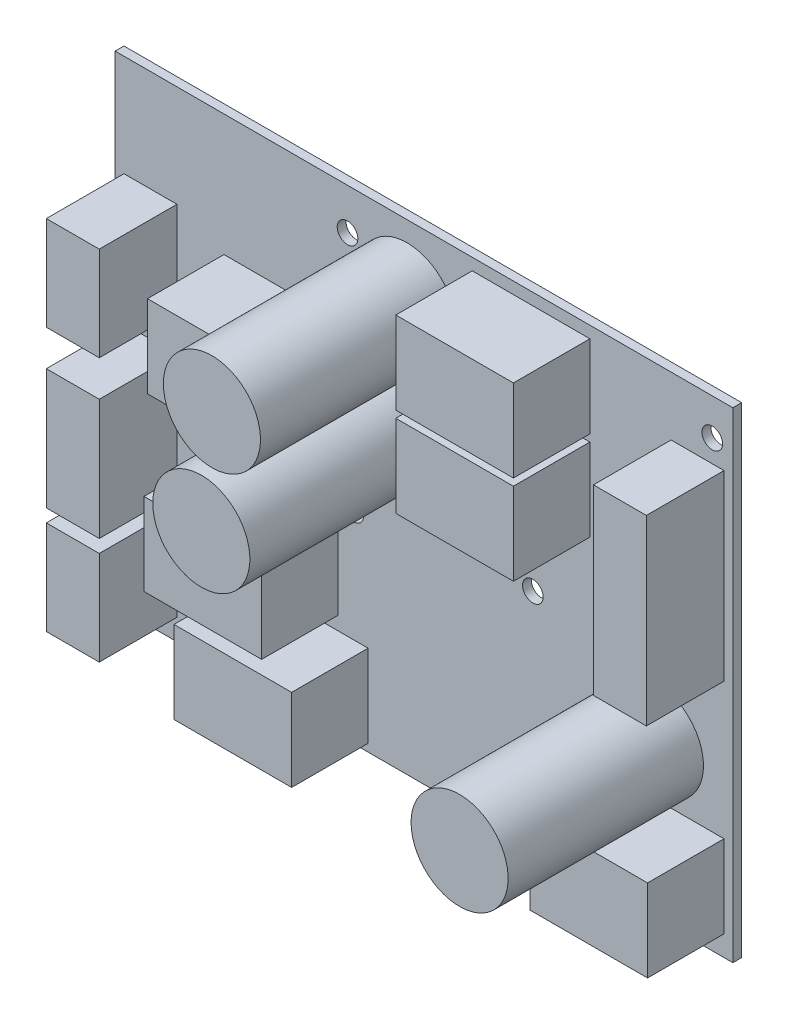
SolidWorks part; units mm, degrees
ref_plane "Přední rovina" through (0, 0, 0) normal (0, 0, 1) x (1, 0, 0)
ref_plane "Horní rovina" through (0, 0, 0) normal (0, 1, 0) x (1, 0, 0)
ref_plane "Pravá rovina" through (0, 0, 0) normal (1, 0, 0) x (0, 0, -1)
sketch "Skica1" plane through (0, 0, 0) normal (0, 0, 1) x (1, 0, 0)
  line L1 (-92.1941, -230.2817) -> (12.8059, -230.2817)
  line L2 (-92.1941, -230.2817) -> (-92.1941, -311.9817)
  line L3 (-92.1941, -311.9817) -> (12.8059, -311.9817)
  line L4 (12.8059, -230.2817) -> (12.8059, -311.9817)
  line L5 (-92.1941, -230.2817) -> (12.8059, -311.9817) construction
  line L6 (-92.1941, -311.9817) -> (12.8059, -230.2817) construction
  circle A0 centre (-21.1941, -274.2817) radius 1.75
  circle A1 centre (9.3059, -236.4817) radius 1.75
  circle A2 centre (-52.6941, -237.2817) radius 1.75
  circle A3 centre (-51.6941, -277.5817) radius 1.75
  point P0 (-39.6941, -271.1317)
  dimension "D3" = 3.5
  dimension "D1" = 6.2
  dimension "D2" = 105
  dimension "D4" = 37.7
  dimension "D5" = 34
  dimension "D6" = 3.5
  dimension "D7" = 81.7
  dimension "D8" = 34.4
  dimension "D9" = 7
  dimension "D10" = 39.5
  dimension "D11" = 40.5
extrude "Přidat vysunutím1" add sketch "Skica1" along normal blind 1.5
sketch "Skica3" plane through (0, 0, 1.5) normal (0, 0, 1) x (1, 0, 0)
  line L0 (12.8059, -230.2817) -> (-92.1941, -230.2817) construction
  line L1 (-90.6941, -247.5817) -> (-81.6941, -247.5817)
  line L2 (-90.6941, -247.5817) -> (-90.6941, -263.5817)
  line L3 (-90.6941, -263.5817) -> (-81.6941, -263.5817)
  line L4 (-81.6941, -247.5817) -> (-81.6941, -263.5817)
  line L5 (-90.6941, -247.5817) -> (-81.6941, -263.5817) construction
  line L6 (-90.6941, -263.5817) -> (-81.6941, -247.5817) construction
  line L7 (-90.6941, -269.6817) -> (-81.6941, -269.6817)
  line L8 (-90.6941, -269.6817) -> (-90.6941, -290.1817)
  line L9 (-90.6941, -290.1817) -> (-81.6941, -290.1817)
  line L10 (-81.6941, -269.6817) -> (-81.6941, -290.1817)
  line L11 (-90.6941, -269.6817) -> (-81.6941, -290.1817) construction
  line L12 (-90.6941, -290.1817) -> (-81.6941, -269.6817) construction
  line L13 (-90.6941, -292.3817) -> (-81.6941, -292.3817)
  line L14 (-90.6941, -292.3817) -> (-90.6941, -308.3817)
  line L15 (-90.6941, -308.3817) -> (-81.6941, -308.3817)
  line L16 (-81.6941, -292.3817) -> (-81.6941, -308.3817)
  line L17 (-90.6941, -292.3817) -> (-81.6941, -308.3817) construction
  line L18 (-90.6941, -308.3817) -> (-81.6941, -292.3817) construction
  line L19 (2.3059, -240.2817) -> (11.3059, -240.2817)
  line L20 (2.3059, -240.2817) -> (2.3059, -271.2817)
  line L21 (2.3059, -271.2817) -> (11.3059, -271.2817)
  line L22 (11.3059, -240.2817) -> (11.3059, -271.2817)
  line L23 (2.3059, -240.2817) -> (11.3059, -271.2817) construction
  line L24 (2.3059, -271.2817) -> (11.3059, -240.2817) construction
  line L25 (12.8059, -311.9817) -> (12.8059, -230.2817) construction
  line L26 (-92.1941, -230.2817) -> (-92.1941, -311.9817) construction
  line L27 (-92.1941, -311.9817) -> (12.8059, -311.9817) construction
  point P0 (-86.1941, -255.5817)
  point P5 (-86.1941, -279.9317)
  point P10 (-86.1941, -300.3817)
  point P15 (6.8059, -255.7817)
  dimension "D1" = 9
  dimension "D2" = 16
  dimension "D3" = 20.5
  dimension "D4" = 31
  dimension "D5" = 10
  dimension "D6" = 1.5
  dimension "D7" = 1.5
  dimension "D8" = 1.5
  dimension "D9" = 1.5
  dimension "D10" = 3.6
  dimension "D11" = 2.2
  dimension "D12" = 6.1
extrude "Přidat vysunutím2" add sketch "Skica3" along normal blind 13.2
sketch "Skica4" plane through (0, 0, 1.5) normal (0, 0, 1) x (1, 0, 0)
  line L0 (-92.1941, -311.9817) -> (12.8059, -311.9817) construction
  line L1 (-73.6941, -250.9817) -> (-53.6941, -250.9817)
  line L2 (-73.6941, -250.9817) -> (-73.6941, -264.9817)
  line L3 (-73.6941, -264.9817) -> (-53.6941, -264.9817)
  line L4 (-53.6941, -250.9817) -> (-53.6941, -264.9817)
  line L5 (-73.6941, -250.9817) -> (-53.6941, -264.9817) construction
  line L6 (-73.6941, -264.9817) -> (-53.6941, -250.9817) construction
  line L7 (-92.1941, -230.2817) -> (-92.1941, -311.9817) construction
  line L11 (-74.2941, -280.3817) -> (-54.2941, -280.3817)
  line L12 (-74.2941, -280.3817) -> (-74.2941, -294.3817)
  line L13 (-74.2941, -294.3817) -> (-54.2941, -294.3817)
  line L14 (-54.2941, -280.3817) -> (-54.2941, -294.3817)
  line L15 (-69.1941, -296.6817) -> (-49.1941, -296.6817)
  line L16 (-69.1941, -296.6817) -> (-69.1941, -310.6817)
  line L17 (-69.1941, -310.6817) -> (-49.1941, -310.6817)
  line L18 (-49.1941, -296.6817) -> (-49.1941, -310.6817)
  line L19 (-31.4941, -232.2817) -> (-11.4941, -232.2817)
  line L20 (-31.4941, -232.2817) -> (-31.4941, -246.2817)
  line L21 (-31.4941, -246.2817) -> (-11.4941, -246.2817)
  line L22 (-11.4941, -232.2817) -> (-11.4941, -246.2817)
  line L23 (-31.4941, -247.4817) -> (-11.4941, -247.4817)
  line L24 (-31.4941, -247.4817) -> (-31.4941, -261.4817)
  line L25 (-31.4941, -261.4817) -> (-11.4941, -261.4817)
  line L26 (-11.4941, -247.4817) -> (-11.4941, -261.4817)
  line L27 (-8.6941, -294.4817) -> (11.3059, -294.4817)
  line L28 (-8.6941, -294.4817) -> (-8.6941, -308.4817)
  line L29 (-8.6941, -308.4817) -> (11.3059, -308.4817)
  line L30 (11.3059, -294.4817) -> (11.3059, -308.4817)
  line L31 (12.8059, -311.9817) -> (12.8059, -230.2817) construction
  line L32 (12.8059, -230.2817) -> (-92.1941, -230.2817) construction
  point P0 (-63.6941, -257.9817)
  dimension "D1" = 14
  dimension "D2" = 20
  dimension "D3" = 3.5
  dimension "D4" = 1.5
  dimension "D5" = 2
  dimension "D6" = 1.2
  dimension "D7" = 24.3
  dimension "D8" = 24.3
  dimension "D9" = 1.3
  dimension "D10" = 2.3
  dimension "D11" = 15.4
  dimension "D12" = 43
  dimension "D13" = 37.9
  dimension "D14" = 38.5
extrude "Přidat vysunutím3" add sketch "Skica4" along normal blind 13
sketch "Skica5" plane through (0, 0, 1.5) normal (0, 0, 1) x (1, 0, 0)
  line L0 (12.8059, -311.9817) -> (12.8059, -230.2817) construction
  line L1 (-31.4941, -232.2817) -> (-31.4941, -246.2817) construction
  line L2 (-8.6941, -308.4817) -> (11.3059, -308.4817) construction
  line L3 (12.8059, -230.2817) -> (-92.1941, -230.2817) construction
  line L4 (-31.4941, -247.4817) -> (-31.4941, -261.4817) construction
  circle A0 centre (-0.4441, -285.4817) radius 8.25
  circle A1 centre (-42.5441, -241.9317) radius 8.25
  circle A2 centre (-44.3441, -260.4317) radius 8.25
  dimension "D1" = 16.5
  dimension "D2" = 13.25
  dimension "D3" = 23
  dimension "D4" = 11.65
  dimension "D5" = 18.5
  dimension "D6" = 11.05
  dimension "D7" = 12.85
extrude "Přidat vysunutím7" add sketch "Skica5" along normal blind 33.2
